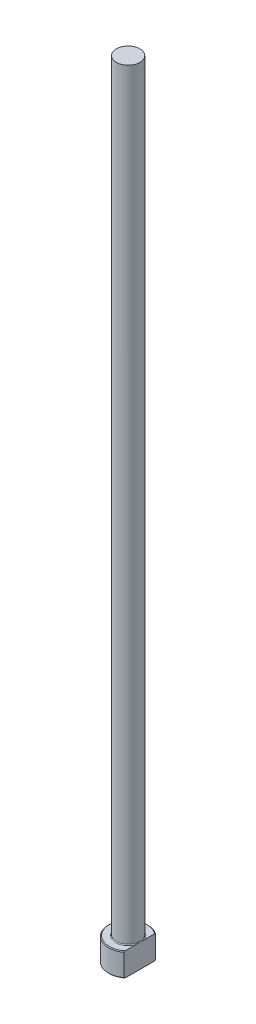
SolidWorks part; units mm, degrees
ref_plane "Front Plane" through (0, 0, 0) normal (0, 0, 1) x (1, 0, 0)
ref_plane "Top Plane" through (0, 0, 0) normal (0, 1, 0) x (1, 0, 0)
ref_plane "Right Plane" through (0, 0, 0) normal (1, 0, 0) x (0, 0, -1)
sketch "Sketch1" plane through (0, 0, 0) normal (0, 0, 1) x (1, 0, 0)
  line L0 (0, 259.9588) -> (0, -15.1925) construction
  line L1 (0, 0) -> (-5, 0)
  line L2 (-5, 0) -> (-5, 6)
  line L3 (-5, 6) -> (-3, 6)
  line L4 (-3, 6) -> (-3, 200)
  line L5 (-3, 200) -> (0, 200)
  line L6 (0, 200) -> (0, 0)
  dimension "L" = 200
  dimension "H" = 10
  dimension "T" = 6
  dimension "D" = 6
revolve "Revolve1" add sketch "Sketch1" angle 360 about L0
chamfer "Chamfer1" distance 0.2 angle 45 2 edges at (0, 6, 5) (0, 0, 5)
fillet "Fillet1" radius 0.2 1 edges at (0, 6, 3)
sketch "Sketch2" plane through (0, 0, 0) normal (0, 1, 0) x (1, 0, 0)
  line L0 (3, -4) -> (3, 4)
  circle A0 centre (0, 0) radius 5 construction
  arc A1 (3, -4) -> (3, 4) centre (0, 0) ccw
  circle A2 centre (0, 0) radius 3 construction
extrude "KEYED HEAD" cut sketch "Sketch2" along normal through all
